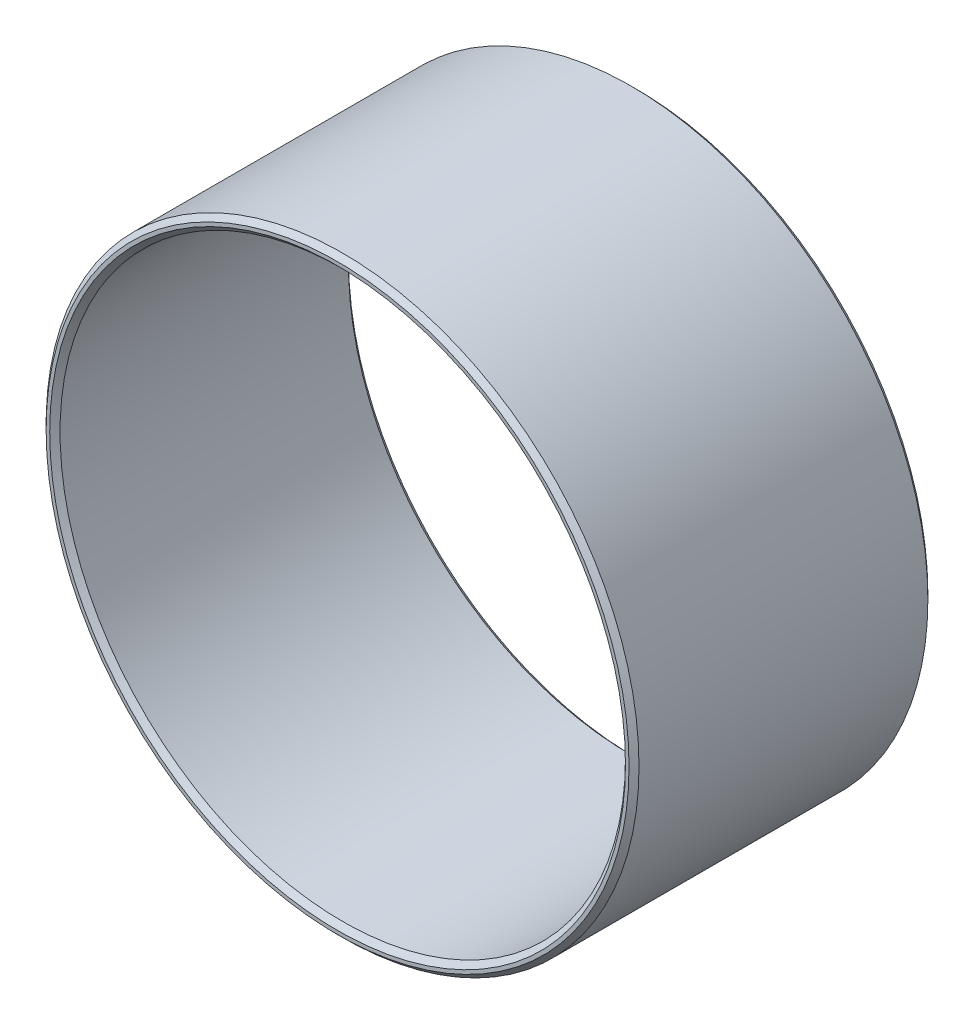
SolidWorks part; units mm, degrees
ref_plane "Front" through (0, 0, 0) normal (0, 0, 1) x (1, 0, 0)
ref_plane "Top" through (0, 0, 0) normal (0, 1, 0) x (1, 0, 0)
ref_plane "Right" through (0, 0, 0) normal (1, 0, 0) x (0, 0, -1)
sketch "Sketch1" plane through (0, 0, 0) normal (0, 0, 1) x (1, 0, 0)
  circle A0 centre (0, 0) radius 188.976
  circle A1 centre (0, 0) radius 180.213
  dimension "D1" = 377.952
  dimension "D2" = 360.426
extrude "Extrude1" add sketch "Sketch1" along normal blind 190.5
chamfer "Chamfer1" distance 3.175 angle 45 2 edges at (188.976, 0, 0) (188.976, 0, 190.5)
chamfer "Chamfer3" distance 3.302 angle 45 2 edges at (180.213, 0, 0) (180.213, 0, 190.5)
